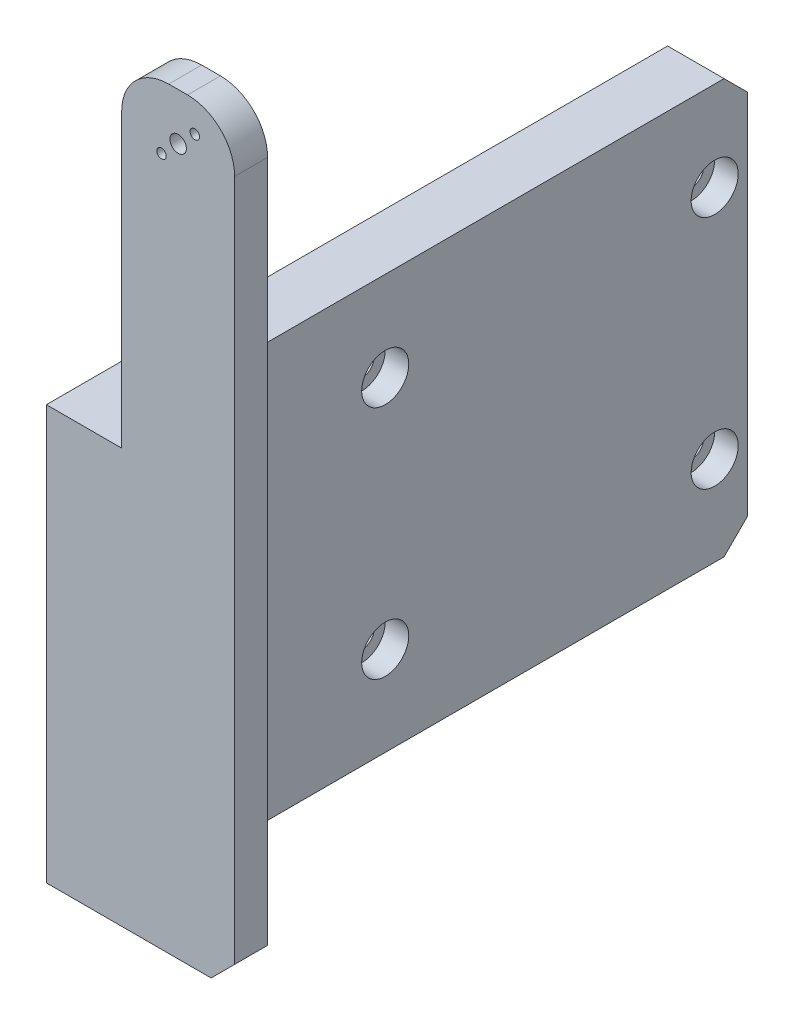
SolidWorks part; units mm, degrees
ref_plane "Plan de face" through (0, 0, 0) normal (0, 0, 1) x (1, 0, 0)
ref_plane "Plan de dessus" through (0, 0, 0) normal (0, 1, 0) x (1, 0, 0)
ref_plane "Plan de droite" through (0, 0, 0) normal (1, 0, 0) x (0, 0, -1)
sketch "Esquisse1" plane through (0, 0, 0) normal (0, 0, 1) x (1, 0, 0)
  line L0 (2242.3756, 777.9629) -> (2242.3756, 757.9629) construction
  line L1 (2230.3756, 777.9629) -> (2254.3756, 777.9629)
  line L2 (2230.3756, 777.9629) -> (2230.3756, 617.9629)
  line L3 (2230.3756, 617.9629) -> (2254.3756, 617.9629)
  line L4 (2254.3756, 777.9629) -> (2254.3756, 617.9629)
  point P6 (2242.3756, 767.9629)
  dimension "D1" = 24
  dimension "D3" = 10
  dimension "D4" = 160
extrude "Boss.-Extru.1" add sketch "Esquisse1" along normal blind 7
sketch "Esquisse2" plane through (2230.3756, 0, 0) normal (-1, 0, 0) x (0, 0, 1)
  line L0 (0, 777.9629) -> (0, 617.9629) construction
  line L1 (7, 617.9629) -> (0, 617.9629)
  line L2 (7, 617.9629) -> (7, 705.9629)
  line L3 (7, 705.9629) -> (0, 705.9629)
  line L4 (0, 617.9629) -> (0, 705.9629)
  dimension "D1" = 88
extrude "Boss.-Extru.2" add sketch "Esquisse2" along normal blind 16
sketch "Esquisse3" plane through (0, 0, 0) normal (0, 0, -1) x (-1, 0, 0)
  line L1 (-2214.3756, 617.9629) -> (-2226.3756, 617.9629)
  line L2 (-2214.3756, 617.9629) -> (-2214.3756, 705.9629)
  line L3 (-2214.3756, 705.9629) -> (-2226.3756, 705.9629)
  line L4 (-2226.3756, 617.9629) -> (-2226.3756, 705.9629)
  line L5 (-2214.3756, 705.9629) -> (-2230.3756, 705.9629) construction
  dimension "D1" = 12
extrude "Boss.-Extru.3" add sketch "Esquisse3" along normal blind 130
fillet "Congé1" radius 6 1 edges at (2226.3756, 661.9629, 0)
sketch "Esquisse4" plane through (0, 0, 7) normal (0, 0, 1) x (1, 0, 0)
  line L0 (2254.3756, 777.9629) -> (2230.3756, 777.9629) construction
  line L1 (2254.3756, 617.9629) -> (2254.3756, 777.9629) construction
  circle A0 centre (2242.3756, 767.9629) radius 1.75
  dimension "D3" = 3.5
  dimension "D1" = 10
  dimension "D2" = 12
extrude "Enlèv. mat.-Extru.1" cut sketch "Esquisse4" against normal blind 10
sketch "Esquisse6" plane through (0, 0, 7) normal (0, 0, 1) x (1, 0, 0)
  line L0 (2238.1269, 765.1351) -> (2239.5475, 763.7144) construction
  line L1 (2245.9139, 771.5009) -> (2242.3756, 767.9629) construction
  line L2 (2242.3756, 767.9629) -> (2238.8372, 764.4248) construction
  line L3 (2254.3756, 617.9629) -> (2254.3756, 777.9629) construction
  circle A0 centre (2245.9139, 771.5009) radius 1.0046
  circle A1 centre (2238.8372, 764.4248) radius 1.0046
  circle A2 centre (2242.3756, 767.9629) radius 1.75 construction
  dimension "D1" = 5.0038
  dimension "D3" = 2.0091
  dimension "D4" = 2.0091
  dimension "D2" = 45.002
extrude "Enlèv. mat.-Extru.3" cut sketch "Esquisse6" against normal blind 10
chamfer "Chanfrein1" distance 0.5 angle 45 2 edges at (2239.8418, 764.4248, 0) (2246.9185, 771.5009, 0)
fillet "Congé2" radius 10 2 edges at (2254.3756, 777.9629, 3.5) (2230.3756, 777.9629, 3.3284)
chamfer "Chanfrein2" distance 5 angle 45 3 edges at (2220.3756, 705.9629, -130) (2220.3756, 617.9629, -130) (2254.3756, 617.9629, 3.5)
sketch "Esquisse7" plane through (2226.3756, 0, 0) normal (1, 0, 0) x (0, 0, -1)
  line L0 (130, 700.9629) -> (130, 622.9629) construction
  line L1 (125, 705.9629) -> (6, 705.9629) construction
  circle A0 centre (123, 636.9629) radius 2.65
  circle A1 centre (123, 686.9629) radius 2.65
  circle A2 centre (53, 636.9629) radius 2.65
  circle A3 centre (53, 686.9629) radius 2.65
  dimension "D5" = 5.3
  dimension "D1" = 50
  dimension "D2" = 70
  dimension "D3" = 7
  dimension "D4" = 19
extrude "Enlèv. mat.-Extru.4" cut sketch "Esquisse7" against normal through all
sketch "Esquisse8" plane through (2226.3756, 0, 0) normal (1, 0, 0) x (0, 0, -1)
  circle A0 centre (53, 686.9629) radius 5
  circle A1 centre (123, 686.9629) radius 5
  circle A2 centre (53, 636.9629) radius 5
  circle A3 centre (123, 636.9629) radius 5
  dimension "D1" = 10
extrude "Enlèv. mat.-Extru.5" cut sketch "Esquisse8" against normal blind 5
sketch "Esquisse9" plane through (0, 705.9629, 0) normal (0, 1, 0) x (1, 0, 0)
  line L0 (2230.3756, -7) -> (2230.3756, 0.3431) construction
  line L1 (2232.3756, 0) -> (2230.3756, 0)
  line L2 (2232.3756, 0) -> (2232.3756, 2.033)
  line L3 (2232.3756, 2.033) -> (2230.3756, 2.033)
  line L4 (2230.3756, 0) -> (2230.3756, 2.033)
extrude "Enlèv. mat.-Extru.6" cut sketch "Esquisse9" along normal through all
